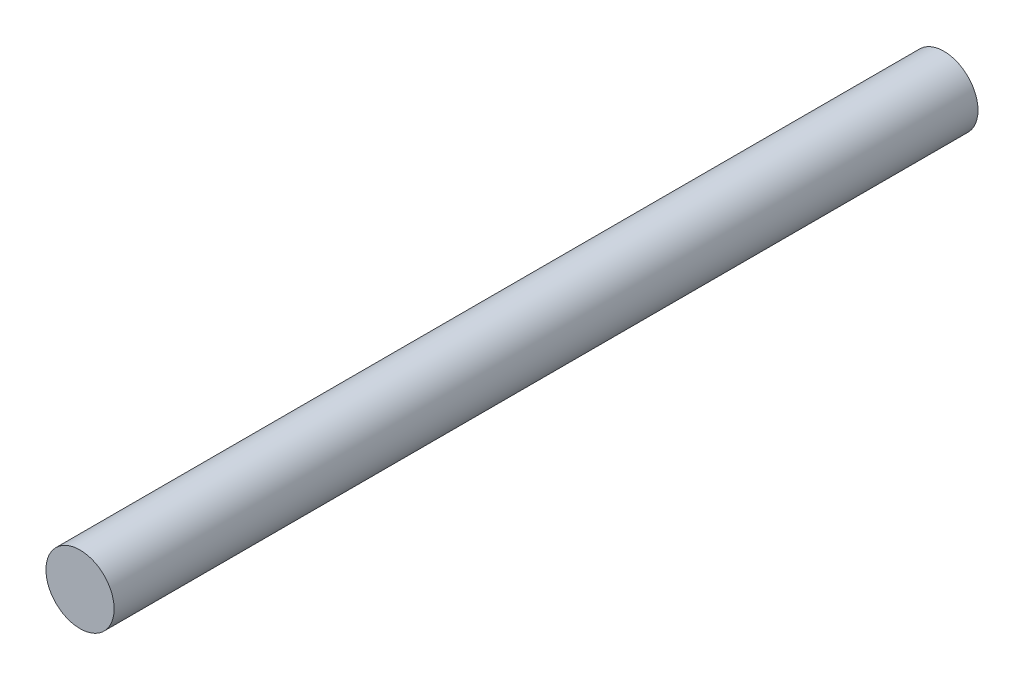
SolidWorks part; units mm, degrees
ref_plane "Front Plane" through (0, 0, 0) normal (0, 0, 1) x (1, 0, 0)
ref_plane "Top Plane" through (0, 0, 0) normal (0, 1, 0) x (1, 0, 0)
ref_plane "Right Plane" through (0, 0, 0) normal (1, 0, 0) x (0, 0, -1)
sketch "Sketch1" plane through (0, 0, 0) normal (0, 0, 1) x (1, 0, 0)
  circle A0 centre (0, 0) radius 2.3813
  dimension "D1" = 4.7625
extrude "Boss-Extrude1" add sketch "Sketch1" against normal blind 60.325
